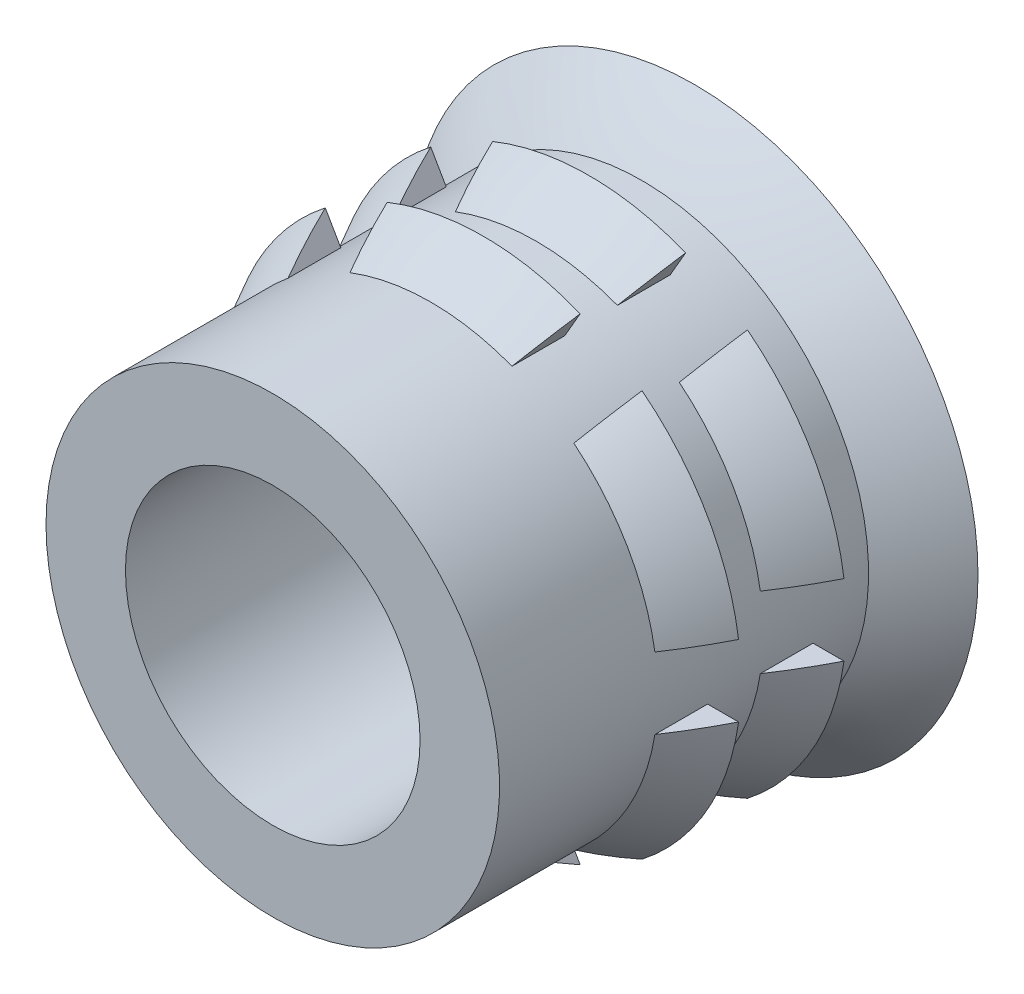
SolidWorks part; units mm, degrees
other "<insert M4 S1>-<CirPattern1>"
ref_plane "Front" through (0, 0, 0) normal (0, 0, 1) x (1, 0, 0)
ref_plane "Top" through (0, 0, 0) normal (0, 1, 0) x (1, 0, 0)
ref_plane "Right" through (0, 0, 0) normal (1, 0, 0) x (0, 0, -1)
inserted part "insert M4 S1"
move or copy body "Body-Move/Copy4"
